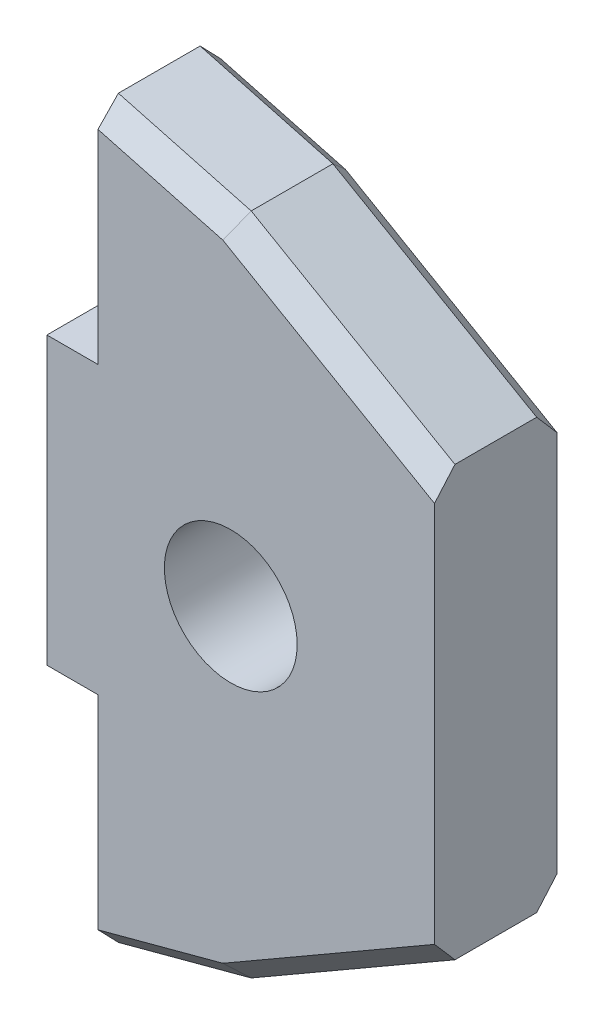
SolidWorks part; units mm, degrees
ref_plane "Front Plane" through (0, 0, 0) normal (0, 0, 1) x (1, 0, 0)
ref_plane "Top Plane" through (0, 0, 0) normal (0, 1, 0) x (1, 0, 0)
ref_plane "Right Plane" through (0, 0, 0) normal (1, 0, 0) x (0, 0, -1)
other "Configuration Table"
sketch "草图1" plane through (0, 0, 0) normal (0, 0, 1) x (1, 0, 0)
  line L0 (-12.4998, 0) -> (13.6122, 0) construction
  line L1 (0, 32.5167) -> (0, -12.2407) construction
  line L2 (-18, -14) -> (-18, 14)
  line L3 (-18, 14) -> (-13, 14)
  line L4 (-13, 14) -> (-13, 36)
  line L5 (-13, 36) -> (0, 32.5167)
  line L6 (0, 32.5167) -> (19.9474, 21)
  line L7 (19.9474, 21) -> (19.9474, -21)
  line L8 (0, -32.5167) -> (19.9474, -21)
  line L9 (-13, -36) -> (0, -32.5167)
  line L10 (-13, -14) -> (-13, -36)
  line L11 (-18, -14) -> (-13, -14)
  circle A0 centre (0, 0) radius 6.5
  point P14 (19.9474, 0)
  point P18 (-18, 0)
  dimension "D1" = 13
  dimension "D2" = 14
  dimension "D3" = 5
  dimension "D4" = 18
  dimension "D5" = 15
  dimension "D6" = 36
  dimension "D7" = 30
  dimension "D8" = 21
extrude "凸台-拉伸1" add sketch "草图1" along normal blind 12
chamfer "倒角1" distance 2 angle 45 8 edges at (-6.5, -34.2583, 0) (9.9737, -26.7583, 0) (-6.5, -34.2583, 12) (9.9737, -26.7583, 12) (-6.5, 34.2583, 0) (9.9737, 26.7583, 0) (9.9737, 26.7583, 12) (-6.5, 34.2583, 12)
